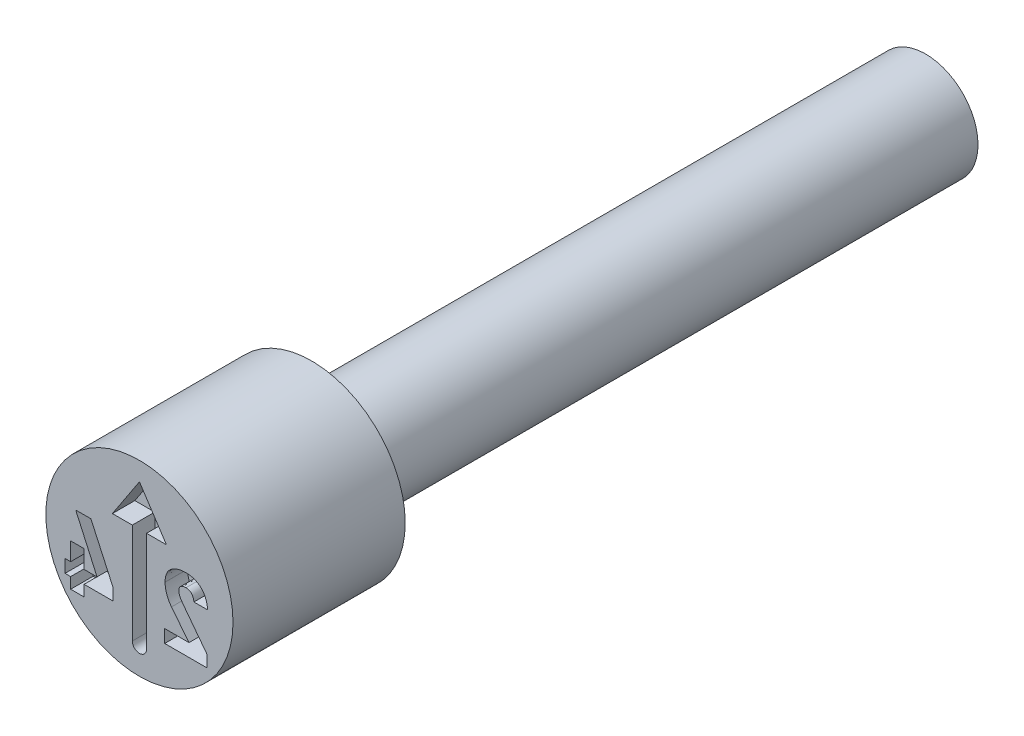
SolidWorks part; units mm, degrees
ref_plane "Front Plane" through (0, 0, 0) normal (0, 0, 1) x (1, 0, 0)
ref_plane "Top Plane" through (0, 0, 0) normal (0, 1, 0) x (1, 0, 0)
ref_plane "Right Plane" through (0, 0, 0) normal (1, 0, 0) x (0, 0, -1)
sketch "Sketch2" plane through (0, 0, 0) normal (1, 0, 0) x (0, 0, -1)
  line L0 (0.4039, 0) -> (50000.4039, 0) construction
  line L6 (0, 1.25) -> (0, 0)
  line L7 (2.3, 1.25) -> (0, 1.25)
  line L8 (2.3, 0.7) -> (2.3, 1.25)
  line L9 (10.5, 0.7) -> (2.3, 0.7)
  line L10 (10.5, 0) -> (10.5, 0.7)
  line L11 (0, 0) -> (10.5, 0)
  dimension "D1" = 2.5
  dimension "D2" = 1.4
  dimension "D3" = 10.5
  dimension "D4" = 2.3
revolve "Revolve1" add sketch "Sketch2" angle 360 about L0
sketch "Sketch3" plane through (0, 0, 0) normal (0, 0, 1) x (1, 0, 0)
  line L0 (0, 0) -> (0, 50000) construction
  line L1 (0.0952, 0.4532) -> (0.0952, -0.8881)
  line L2 (0.361, 0.4532) -> (0.0952, 0.4532)
  line L3 (0, 1.0011) -> (0.361, 0.4532)
  line L15 (0, 1.0011) -> (-0.361, 0.4532)
  line L16 (-0.361, 0.4532) -> (-0.0952, 0.4532)
  line L17 (-0.0952, 0.4532) -> (-0.0952, -0.8881)
  arc A2 (-0.0952, -0.8881) -> (0.0952, -0.8881) centre (0, -0.8881) ccw
extrude "Cut-Extrude4" cut sketch "Sketch3" against normal blind 0.3
sketch "Sketch4" plane through (0, 0, 0) normal (0, 0, 1) x (1, 0, 0)
  text T0 "2  4" font "Bahnschrift" height 0.95
  dimension "D1" = 0.7
extrude "Cut-Extrude5" cut sketch "Sketch4" against normal blind 0.3
